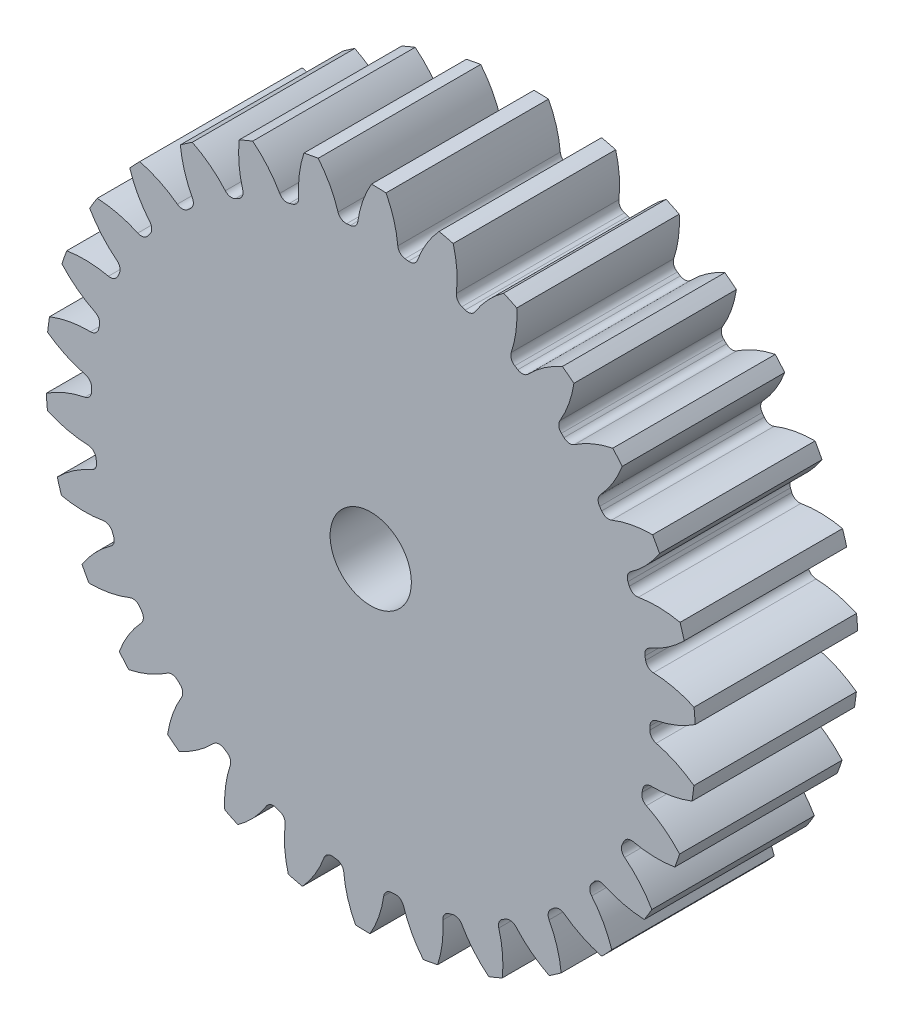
SolidWorks part; units mm, degrees
ref_plane "Front" through (0, 0, 0) normal (0, 0, 1) x (1, 0, 0)
ref_plane "Top" through (0, 0, 0) normal (0, 1, 0) x (1, 0, 0)
ref_plane "Right" through (0, 0, 0) normal (1, 0, 0) x (0, 0, -1)
sketch "Sketch3" plane through (0, 0, 0) normal (0, 0, 1) x (1, 0, 0)
  circle A0 centre (0, 0) radius 203.2
  dimension "od" = 406.4
extrude "gearBody" add sketch "Sketch3" along normal blind 101.6
sketch "Sketch2" plane through (0, 0, 0) normal (0, 0, 1) x (1, 0, 0)
  line L0 (0, 0) -> (165.385, 68.5047) construction
  line L1 (202.364, -21.9466) -> (0, 0) construction
  line L2 (0, 0) -> (36.3143, 0) construction
  line L3 (190.4279, 5.2422) -> (189.9378, -14.625) construction
  line L5 (190.1828, -4.6914) -> (0, 0) construction
  line L7 (0, 0) -> (179.0114, 0) construction
  arc A0 (179.002, 1.8424) -> (178.6934, -10.6659) centre (0, 0) ccw construction
  arc A1 (202.8619, 11.7176) -> (202.0374, -21.7056) centre (0, 0) ccw construction
  arc A2 (190.4279, 5.2422) -> (189.9378, -14.625) centre (0, 0) ccw construction
  arc A3 (174.5406, -5.4296) -> (174.596, -3.1829) centre (0, 0) ccw
  arc A4 (202.364, -21.9466) -> (178.4431, -10.6023) centre (161.8062, -76.5758) ccw
  arc A5 (202.364, -21.9466) -> (203.2, 11.9422) centre (0, 0) ccw
  arc A6 (203.2, 11.9422) -> (178.7488, 1.7911) centre (165.385, 68.5047) cw
  arc A7 (174.596, -3.1829) -> (178.7488, 1.7911) centre (179.764, -3.2771) cw
  arc A8 (178.4431, -10.6023) -> (174.5406, -5.4296) centre (179.707, -5.5903) cw
  point P6 (203.2, 11.9422)
  point P22 (202.364, -21.9466)
  dimension "baseDia" = 358.0229
  dimension "od" = 406.4
  dimension "pd" = 381
  dimension "rd" = 349.25
  dimension "rFillet" = 5.1689
  dimension "pointX" = 203.2
  dimension "pointY" = 11.9422
  dimension "CTT" = 19.8672
  dimension "flankCenterAngle" = 22.5
extrude "toothCut" cut sketch "Sketch2" along normal through all
pattern_circular "CirPattern1" count 30 over 360 about axis through (0, 0, 0) along (0, 0, 1) of "toothCut"
sketch "hub1Dia" plane through (0, 0, 0) normal (0, 0, -1) x (-1, 0, 0)
  circle A0 centre (0, 0) radius 12.7
  dimension "hub1Dia" = 25.4
sketch "hub2Dia" plane through (0, 0, 101.6) normal (0, 0, 1) x (1, 0, 0)
  circle A0 centre (0, 0) radius 12.7
  dimension "hub2dia" = 25.4
sketch "boreDia" plane through (0, 0, 0) normal (0, 0, 1) x (1, 0, 0)
  circle A0 centre (0, 0) radius 25.4
  dimension "boreDia" = 50.8
extrude "bore" cut sketch "boreDia" against normal mid plane 25400
